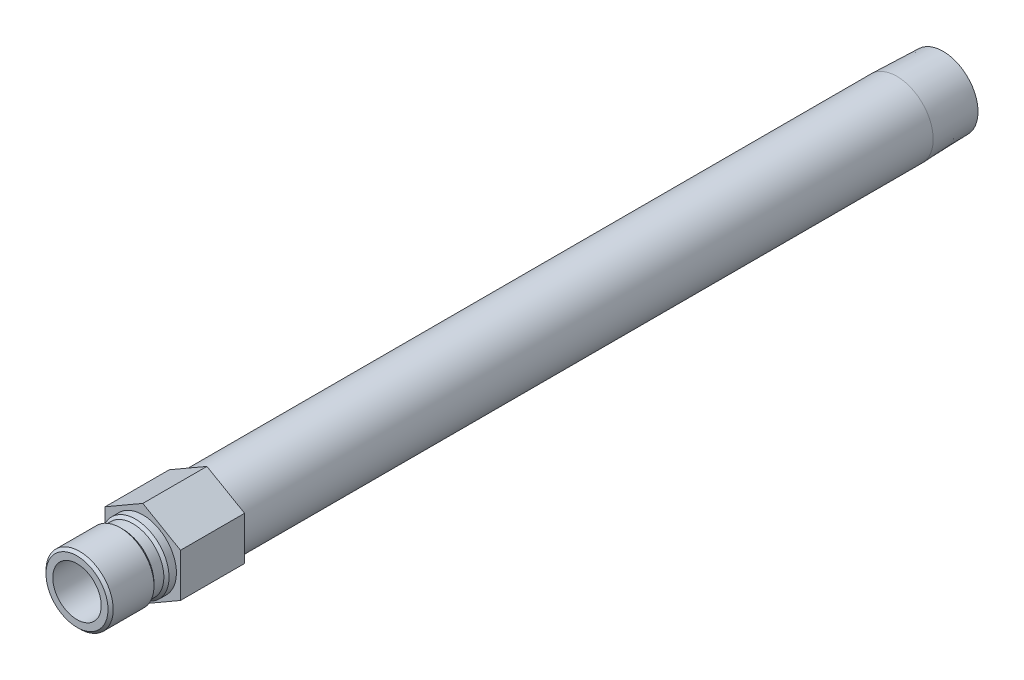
SolidWorks part; units mm, degrees
ref_plane "Front Plane" through (0, 0, 0) normal (0, 0, 1) x (1, 0, 0)
ref_plane "Top Plane" through (0, 0, 0) normal (0, 1, 0) x (1, 0, 0)
ref_plane "Right Plane" through (0, 0, 0) normal (1, 0, 0) x (0, 0, -1)
sketch "Sketch1" plane through (0, 0, 0) normal (1, 0, 0) x (0, 0, -1)
  line L0 (0, 0) -> (-22.479, 0) construction
  line L1 (-19.304, 7.112) -> (-19.304, 9.0932)
  line L2 (-5.8166, 9.0932) -> (-5.8166, 0) construction
  line L3 (-18.542, 9.8552) -> (-6.5786, 9.8552)
  line L4 (0, 10.668) -> (0, 0) construction
  line L5 (-5.8166, 9.0932) -> (-2.921, 9.0932)
  line L6 (-2.159, 9.8552) -> (0, 9.8552)
  line L7 (0, 9.8552) -> (0, 10.668)
  line L8 (-5.8166, 9.0932) -> (-6.5786, 9.8552)
  line L9 (-2.921, 9.0932) -> (-2.159, 9.8552)
  line L10 (-19.304, 9.0932) -> (-18.542, 9.8552)
  line L11 (-19.304, 7.112) -> (-1.524, 7.112)
  line L12 (0, 10.668) -> (221.1324, 10.668)
  line L13 (221.1324, 10.668) -> (234.696, 10.2441)
  line L14 (234.696, 10.2441) -> (234.696, 7.8994)
  line L15 (0, 9.8552) -> (18.796, 9.8552) construction
  line L16 (18.796, 9.8552) -> (18.796, 0) construction
  line L17 (18.796, 0) -> (0, 0) construction
  line L18 (-1.524, 7.112) -> (-1.1053, 7.8994)
  line L19 (-1.1053, 7.8994) -> (234.696, 7.8994)
  dimension "D1" = 19.304
  dimension "D2" = 2.8956
  dimension "D3" = 0.762
  dimension "D4" = 45
  dimension "D5" = 13.4874
  dimension "D6" = 45
  dimension "D7" = 1.79
  dimension "D8" = 13.5636
  dimension "D9" = 254
  dimension "D10" = 3.175
  dimension "D11" = 38.1
  dimension "D12" = 14.224
  dimension "D13" = 21.336
  dimension "D14" = 19.7104
  dimension "D15" = 15.7988
  dimension "D16" = 118
  dimension "D17" = 17.78
revolve "Revolve1" add sketch "Sketch1" angle 360 about L0
sketch "Sketch2" plane through (0, 0, 0) normal (0, 0, 1) x (1, 0, 0)
  line L1 (-11.049, 6.3791) -> (-11.049, -6.3791)
  line L2 (-11.049, -6.3791) -> (0, -12.7583)
  line L3 (0, -12.7583) -> (11.049, -6.3791)
  line L4 (11.049, -6.3791) -> (11.049, 6.3791)
  line L5 (11.049, 6.3791) -> (0, 12.7583)
  line L6 (0, 12.7583) -> (-11.049, 6.3791)
  circle A0 centre (0, 0) radius 11.049 construction
  circle A1 centre (0, 0) radius 7.112 construction
  circle A2 centre (0, 0) radius 7.112
  dimension "D1" = 22.098
extrude "Boss-Extrude1" add sketch "Sketch2" against normal up to vertex (18.796 mm away) from vertex at 0
